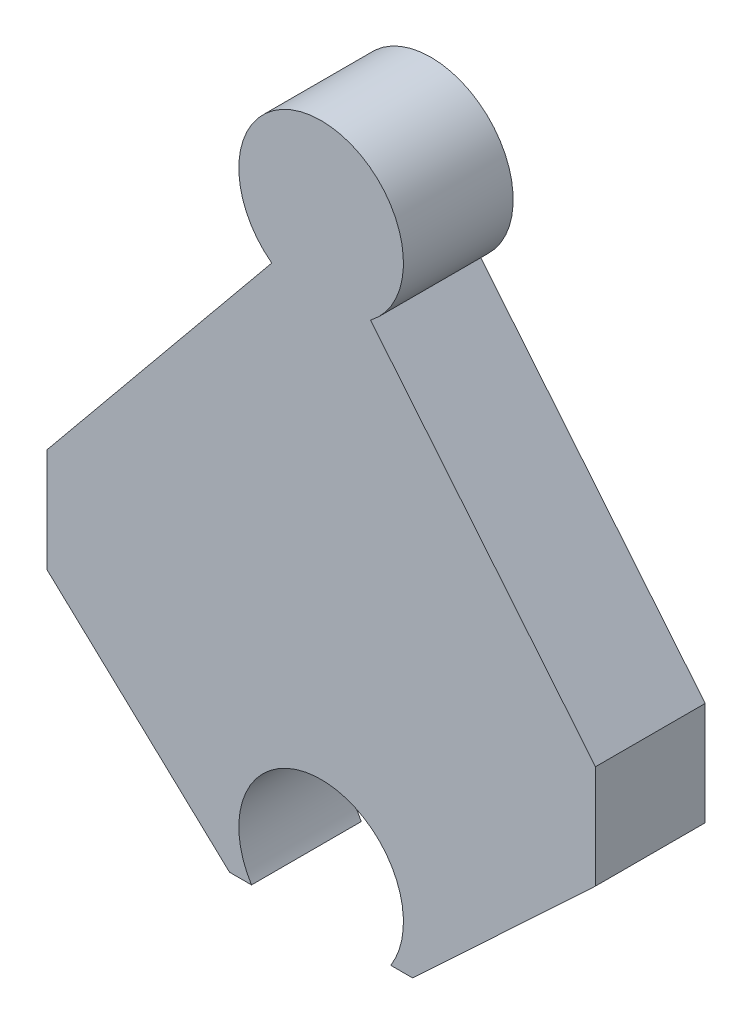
SolidWorks part; units mm, degrees
ref_plane "Ebene vorne" through (0, 0, 0) normal (0, 0, 1) x (1, 0, 0)
ref_plane "Ebene oben" through (0, 0, 0) normal (0, 1, 0) x (1, 0, 0)
ref_plane "Ebene rechts" through (0, 0, 0) normal (1, 0, 0) x (0, 0, -1)
sketch "Skizze1" plane through (0, 0, 0) normal (0, 0, 1) x (1, 0, 0)
  line L0 (-41.6446, 0) -> (0, 0) construction
  line L1 (0, 0) -> (0, 31) construction
  line L2 (25, 25) -> (-25, 25)
  line L3 (-25, 25) -> (-25, -25)
  line L4 (25, 25) -> (25, -25)
  line L5 (25, -25) -> (-25, -25)
  line L6 (0, -25) -> (0, 0) construction
  line L7 (-4.5, 25) -> (-25, 0)
  line L8 (4.5, 25) -> (25, 0)
  line L9 (-8.344, -25) -> (-25, -9.422)
  line L10 (8.344, -25) -> (25, -9.422)
  circle A0 centre (0, 31) radius 7.5
  circle A1 centre (0, -21) radius 7.5
  point P7 (0, -25)
  point P9 (0, 25)
  point P10 (25, 0)
  point P11 (-25, 0)
  dimension "D2" = 15
  dimension "D1" = 50
  dimension "D3" = 6
  dimension "D4" = 4
extrude "Linear austragen2" add sketch "Skizze1" against normal blind 10
sketch "Skizze2" plane through (0, 0, 0) normal (0, 0, 1) x (1, 0, 0)
  line L0 (-4.5, 25) -> (-4.5, -27) construction
  line L1 (0, -21) -> (-6.3443, -25) construction
  line L2 (0, -21) -> (6.3443, -25) construction
  line L3 (0, 0) -> (0, 31) construction
  line L4 (0, -21) -> (0, -32.7415) construction
  line L5 (-4.5, -27) -> (0, -21) construction
  line L6 (4.5, -27) -> (0, -21) construction
  circle A0 centre (0, -21) radius 7.5 construction
  arc A1 (-6.3443, -25) -> (0, -28.5) centre (0, -21) ccw construction
  circle A2 centre (0, 31) radius 7.5 construction
  arc A3 (0, -28.5) -> (6.3443, -25) centre (0, -21) ccw construction
  spline S0 degree 3 poles (-4.5, -27) (-3.1769, -27.9923) (-1.6203, -28.5) (0, -28.5) (1.6203, -28.5) (3.1769, -27.9923) (4.5, -27) knots 0.182246 0.182246 0.182246 0.182246 0.5 0.5 0.5 0.817754 0.817754 0.817754 0.817754 weights 0.942366 0.928082 0.947293 1 0.947293 0.928082 0.942366
  point P3 (0, 23.5)
equation "\"LÄNGE\"=0"
equation "\"BREITE\"=0"
equation "\"HÖHE\"=0"
equation "\"DURCHMESSER\"=0"
equation "\"Stückzahl\"= 1"
